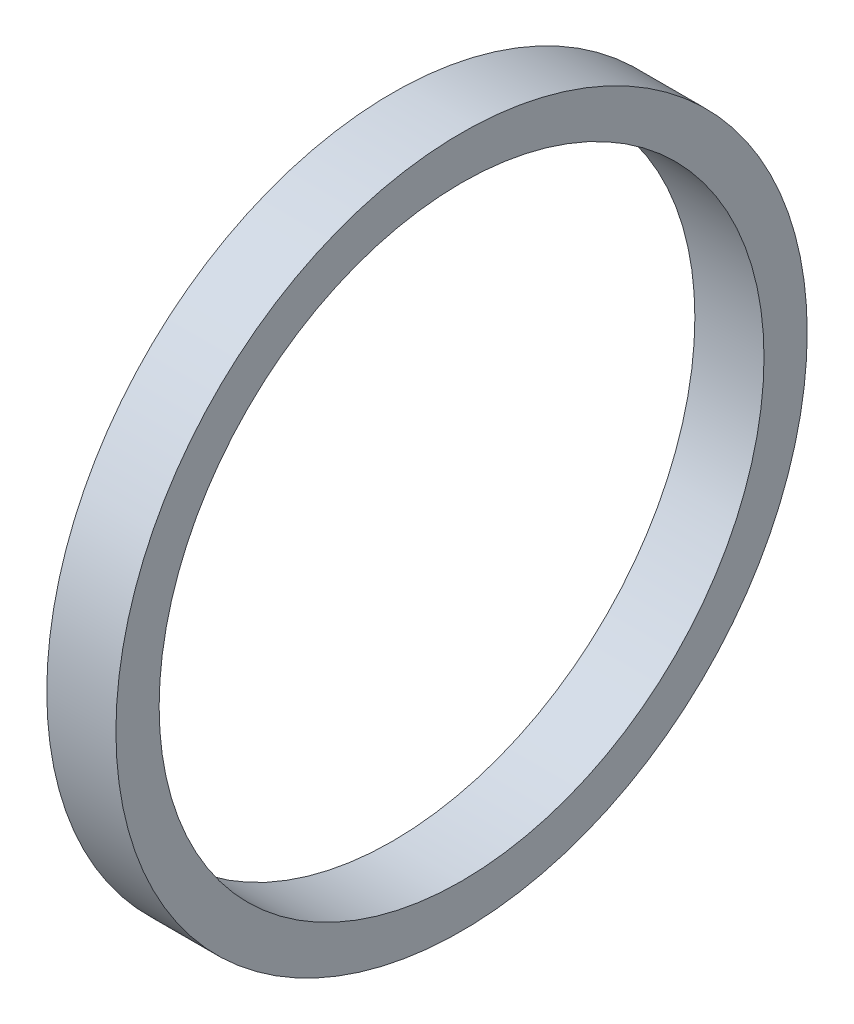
SolidWorks part; units mm, degrees
ref_plane "Front Plane" through (0, 0, 0) normal (0, 0, 1) x (1, 0, 0)
ref_plane "Top Plane" through (0, 0, 0) normal (0, 1, 0) x (1, 0, 0)
ref_plane "Right Plane" through (0, 0, 0) normal (1, 0, 0) x (0, 0, -1)
sketch "Sketch1" plane through (0, 0, 0) normal (0, 0, 1) x (1, 0, 0)
  line L3 (-16, 80) -> (0, 80)
  line L5 (0, 0) -> (-65, 0) construction
  line L6 (-16, 70) -> (0, 70)
  line L7 (-16, 80) -> (-16, 70)
  line L9 (0, 70) -> (0, 80)
  dimension "D1" = 16
  dimension "D2" = 10
  dimension "D3" = 80
revolve "Revolve1" add sketch "Sketch1" angle 360 about L5
